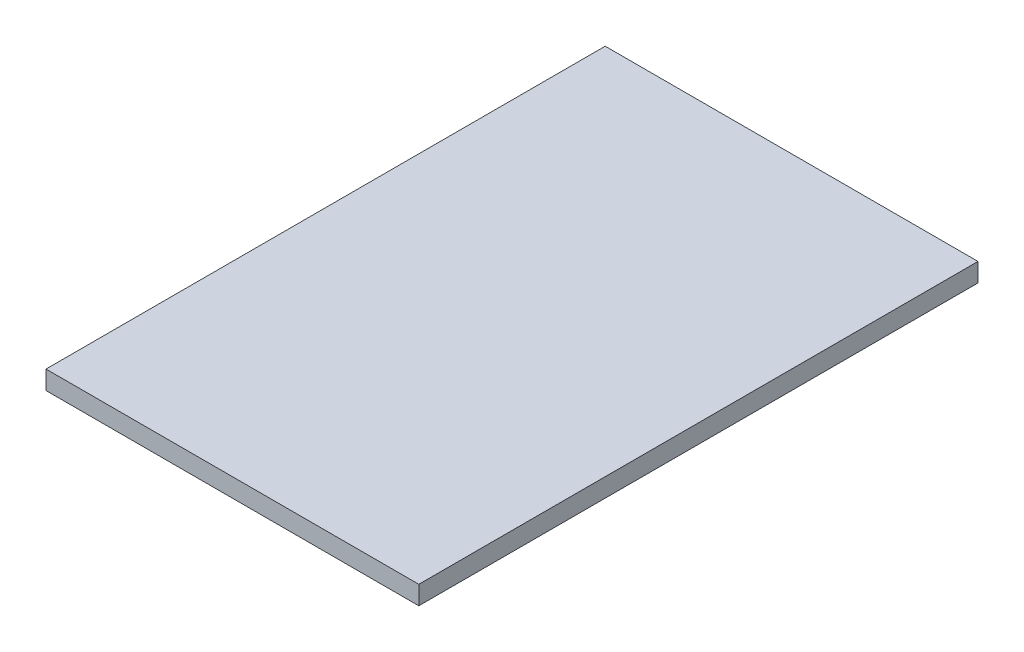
SolidWorks part; units mm, degrees
ref_plane "Front Plane" through (0, 0, 0) normal (0, 0, 1) x (1, 0, 0)
ref_plane "Top Plane" through (0, 0, 0) normal (0, 1, 0) x (1, 0, 0)
ref_plane "Right Plane" through (0, 0, 0) normal (1, 0, 0) x (0, 0, -1)
sketch "Sketch1" plane through (0, 0, 0) normal (0, 1, 0) x (1, 0, 0)
  line L1 (0, 0) -> (20, 0)
  line L2 (0, 0) -> (0, -30)
  line L3 (0, -30) -> (20, -30)
  line L4 (20, 0) -> (20, -30)
  dimension "D1" = 20
  dimension "D2" = 30
extrude "Boss-Extrude1" add sketch "Sketch1" along normal blind 1
